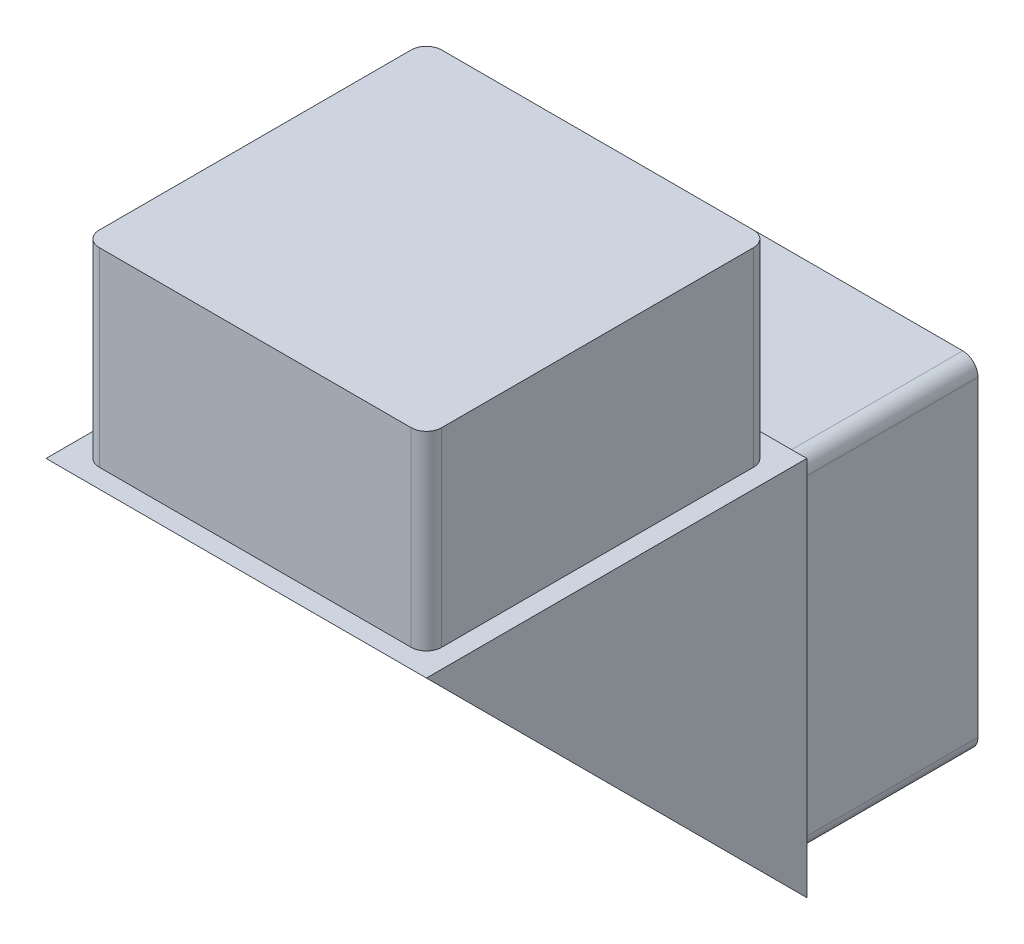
SolidWorks part; units mm, degrees
ref_plane "前视基准面" through (0, 0, 0) normal (0, 0, 1) x (1, 0, 0)
ref_plane "上视基准面" through (0, 0, 0) normal (0, 1, 0) x (1, 0, 0)
ref_plane "右视基准面" through (0, 0, 0) normal (1, 0, 0) x (0, 0, -1)
sketch "草图1" plane through (0, 0, 0) normal (0, 1, 0) x (1, 0, 0)
  line L1 (-10, -10) -> (10, -10)
  line L2 (-10, -10) -> (-10, 10)
  line L3 (-10, 10) -> (10, 10)
  line L4 (10, -10) -> (10, 10)
  line L5 (-10, -10) -> (10, 10) construction
  line L6 (-10, 10) -> (10, -10) construction
  point P0 (0, 0)
  dimension "D1" = 20
  dimension "D2" = 20
extrude "拉伸1" add sketch "草图1" along normal mid plane 20
sketch "草图2" plane through (10, 0, 0) normal (1, 0, 0) x (0, 0, -1)
  line L0 (-10, 10) -> (10, -10)
  line L1 (10, 10) -> (10, -10) construction
  line L2 (-10, 10) -> (-10, -10) construction
  line L3 (-10, -10) -> (10, -10) construction
  line L4 (-10, 10) -> (-10, -10)
  line L5 (-10, -10) -> (10, -10)
extrude "拉伸2" cut sketch "草图2" against normal through all
sketch "草图3" plane through (0, 0, -10) normal (0, 0, -1) x (-1, 0, 0)
  line L0 (-10, 10) -> (10, 10) construction
  line L1 (-9, -9) -> (9, -9)
  line L2 (-9, -9) -> (-9, 9)
  line L3 (-9, 9) -> (9, 9)
  line L4 (9, -9) -> (9, 9)
  line L5 (-9, -9) -> (9, 9) construction
  line L6 (-9, 9) -> (9, -9) construction
  line L7 (10, 10) -> (10, -10) construction
  point P0 (0, 0)
  dimension "D1" = 1
  dimension "D2" = 1
extrude "拉伸3" add sketch "草图3" along normal blind 10
sketch "草图4" plane through (0, 10, 0) normal (0, 1, 0) x (1, 0, 0)
  line L0 (10, -10) -> (10, 10) construction
  line L1 (-9, -9) -> (9, -9)
  line L2 (-9, -9) -> (-9, 9)
  line L3 (-9, 9) -> (9, 9)
  line L4 (9, -9) -> (9, 9)
  line L5 (-9, -9) -> (9, 9) construction
  line L6 (-9, 9) -> (9, -9) construction
  line L7 (-9, 10) -> (9, 10) construction
  point P0 (0, 0)
  dimension "D1" = 1
  dimension "D2" = 1
extrude "拉伸4" add sketch "草图4" along normal blind 10
fillet "圆角1" radius 0.8 8 edges at (9, -9, -15) (9, 9, -15) (-9, -9, -15) (-9, 9, -15) (-9, 15, -9) (-9, 15, 9) (9, 15, 9) (9, 15, -9)
